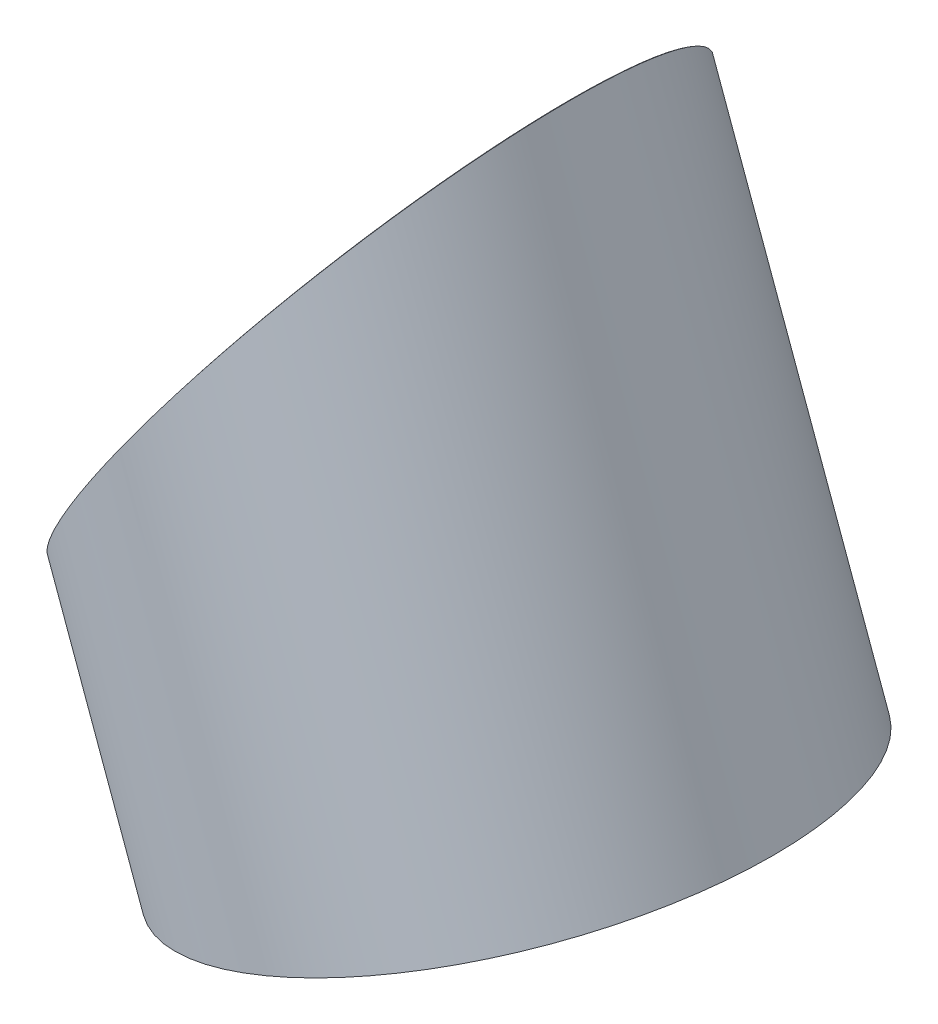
SolidWorks part; units mm, degrees
ref_plane "前视基准面" through (0, 0, 0) normal (0, 0, 1) x (1, 0, 0)
ref_plane "上视基准面" through (0, 0, 0) normal (0, 1, 0) x (1, 0, 0)
ref_plane "右视基准面" through (0, 0, 0) normal (1, 0, 0) x (0, 0, -1)
imported_body "基体零件-两节90°弯头-1"
sheet metal parameters "钣金1" parameters "D1"=0.7366, "厚度"=1
bend "圆角折弯1" bend radius 359 bend angle 359.841 parameters "D5"=1
flatten bends "展开-折弯1"
sketch "尖角-草图1" plane through (319.7808, 261.6942, 0.5) normal (-0.9397, -0.342, 0.0014) x (0.0013, 0.0005, 1)
  line L0 (1127.3332, 136.5406) -> (1127.3332, -136.5406) construction
  dimension "D1" = 0
process bends "加工-折弯1" parameters "D1"=0
sketch "平面-草图1" plane through (319.7808, 261.6942, 0.5) normal (-0.9397, -0.342, 0.0014) x (0.0013, 0.0005, 1)
